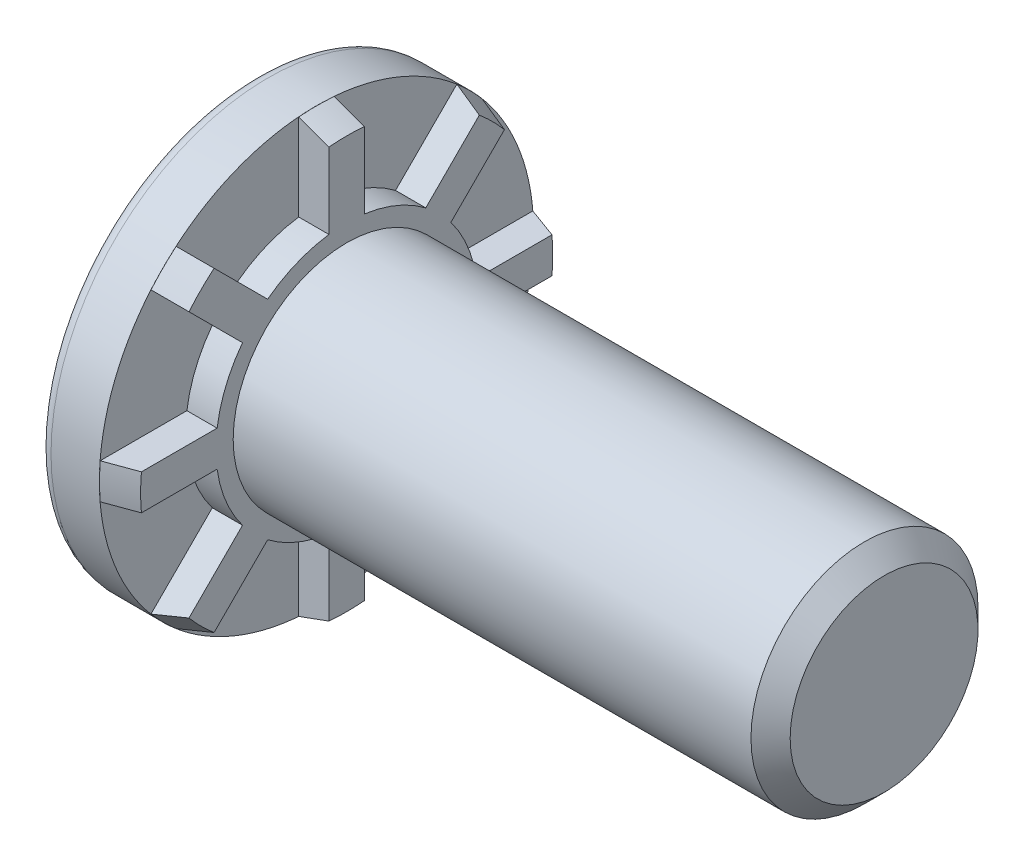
SolidWorks part; units mm, degrees
ref_plane "Plane1" through (0, 0, 0) normal (0, 0, 1) x (1, 0, 0)
ref_plane "Plane2" through (0, 0, 0) normal (0, 1, 0) x (1, 0, 0)
ref_plane "Plane3" through (0, 0, 0) normal (1, 0, 0) x (0, 0, -1)
sketch "BodySke" plane through (0, 0, 0) normal (0, 0, 1) x (1, 0, 0)
  line L0 (-2.13, 7.224) -> (-2.13, 0)
  line L1 (1.065, 7.2608) -> (1.065, 4)
  line L2 (0.0025, 7.6475) -> (1.065, 7.2608)
  line L3 (1.065, 4) -> (19.3095, 4)
  line L4 (20, 3.3095) -> (20, 0)
  line L5 (20, 0) -> (-2.13, 0)
  line L6 (0, 0) -> (50.554, 0) construction
  line L8 (20, 3.3095) -> (19.3095, 4)
  line L9 (-1.704, 7.65) -> (0, 7.65)
  line L10 (0.0025, 7.6475) -> (0, 7.6475)
  line L11 (1.25, 19.05) -> (1.25, -3.175) construction
  line L12 (0, 7.6475) -> (0, 7.65)
  arc A0 (-2.13, 7.224) -> (-1.704, 7.65) centre (-1.704, 7.224) cw
  dimension "D2" = 0.0025
  dimension "Fillet_rad" = 0.426
  dimension "D1" = 20
  dimension "Diameter" = 8
  dimension "D3" = 0.0025
  dimension "Length" = 20
  dimension "Body_ch_ang" = 45
  dimension "Minor_dia" = 6.619
  dimension "Advance" = 1.25
  dimension "H_dia" = 15.3
  dimension "T_dim" = 2.13
  dimension "Clinch_ht" = 1.065
revolve "BaseBody" add sketch "BodySke" angle 360 about L6
sketch "ThdSchSke" plane through (0, 0, 0) normal (0, 0, 1) x (1, 0, 0)
  line L0 (3.3, -3.3095) -> (2.8165, -4)
  line L1 (3.3, -3.3095) -> (3.7835, -4)
  line L2 (3.7835, -4) -> (3.7835, -5)
  line L3 (-3.175, 0) -> (5.1513, 0) construction
  line L4 (0, -7.65) -> (0, 7.65) construction
  line L5 (3.7835, -5) -> (2.8165, -5)
  line L6 (2.8165, -5) -> (2.8165, -4)
  dimension "Thread_minor" = 6.619
  dimension "Diameter" = 8
  dimension "Start" = 3.3
  dimension "SideAngle" = 55
  dimension "VeeAngle" = 70
  dimension "Overcut" = 10
revolve "ThreadSchematic" [suppressed] cut sketch "ThdSchSke" angle 360 about L3
pattern_linear "ThdSchPat" [suppressed]
sketch "RibCutSke" plane through (1.065, 1.7944, -0.091) normal (1, 0, 0) x (0, 0, -1)
  line L0 (0.5348, 2.7713) -> (0.5348, 5.83)
  line L1 (2.695, 1.8765) -> (4.8578, 4.0393)
  line L2 (0.5348, 2.1564) -> (0.5348, 2.4006) construction
  line L3 (-0.091, -1.7944) -> (-0.091, 5.0239) construction
  line L4 (-0.091, -1.7944) -> (0.5348, 2.1564) construction
  line L5 (-0.091, -1.7944) -> (2.2602, 1.4417) construction
  line L6 (2.2602, 1.4417) -> (2.4379, 1.6194) construction
  arc A1 (2.695, 1.8765) -> (0.5348, 2.7713) centre (-0.091, -1.7944) ccw
  arc A2 (4.8578, 4.0393) -> (0.5348, 5.83) centre (-0.091, -1.7944) ccw
  circle A3 centre (-0.091, -1.7944) radius 7.2608 construction
  circle A4 centre (-0.091, -1.7944) radius 4 construction
  dimension "Inner_dia" = 9.2167
  dimension "Outer_dia" = 15.3
  dimension "Rib_root_dia" = 8
  dimension "Rib_root_half_angle" = 9
  dimension "Rib_root_gap_angle" = 27
  dimension "Angle" = 45
extrude "RibCut" cut sketch "RibCutSke" against normal blind 1.065
pattern_circular "RibCutsPat" count 8 every 45 about axis through (0, 0, 0) along (1, 0, 0) of "RibCut"
equation "' \"Length@BodySke\" = 20"
equation "' \"H_dia@BodySke\" = 15.3"
equation "' \"Start@ThdSchSke\" = 3.3"
equation "' \"T_dim@BodySke\" = 2.13"
equation "' \"Diameter@BodySke\" = 8"
equation "' \"Minor_dia@BodySke\" = 6.619"
equation "' \"Advance@BodySke\" = 1.25"
equation "\"Fillet_rad@BodySke\" =  \"T_dim@BodySke\" * 0.2"
equation "\"Clinch_ht@BodySke\" = \"T_dim@BodySke\" * 0.5"
equation "\"Num_ribs@RibCutsPat\" = 8"
equation "\"Angle@RibCutSke\" =\"Angle@RibCutsPat\""
equation "\"Rib_root_half_angle@RibCutSke\" = \"Angle@RibCutSke\" / 5"
equation "\"Rib_root_gap_angle@RibCutSke\" = \"Angle@RibCutSke\" - (2 * \"Rib_root_half_angle@RibCutSke\" )"
equation "\"Rib_root_dia@RibCutSke\" = \"Diameter@BodySke\""
equation "\"Inner_dia@RibCutSke\" = \"Diameter@BodySke\" + ( \"H_dia@BodySke\" - \"Diameter@BodySke\" ) / 6"
equation "\"Outer_dia@RibCutSke\" = \"H_dia@BodySke\""
equation "\"Depth@RibCut\" = \"Clinch_ht@BodySke\""
equation "\"Thread_length@ThreadCosmetic\" = \"Length@BodySke\" - \"Start@ThdSchSke\""
equation "\"Thread_minor@ThreadCosmetic\" = \"Minor_dia@BodySke\""
equation "\"Thread_minor@ThdSchSke\" = \"Minor_dia@BodySke\""
equation "\"Diameter@ThdSchSke\" = \"Diameter@BodySke\""
equation "\"Overcut@ThdSchSke\" = \"Diameter@BodySke\" * 1.25"
equation "\"Num_threads@ThdSchPat\" = int( \"Thread_length@ThreadCosmetic\" / \"Advance@BodySke\" + 0.999 )  + 1"
equation "\"Advance@ThdSchPat\" = \"Thread_length@ThreadCosmetic\" /  (\"Num_threads@ThdSchPat\" - 1) 'relax it"
equation "\"Num_threads@ThdSchPat\" = \"Num_threads@ThdSchPat\" - sgn( \"Num_threads@ThdSchPat\" - 1) '---chamfered tips only---"
